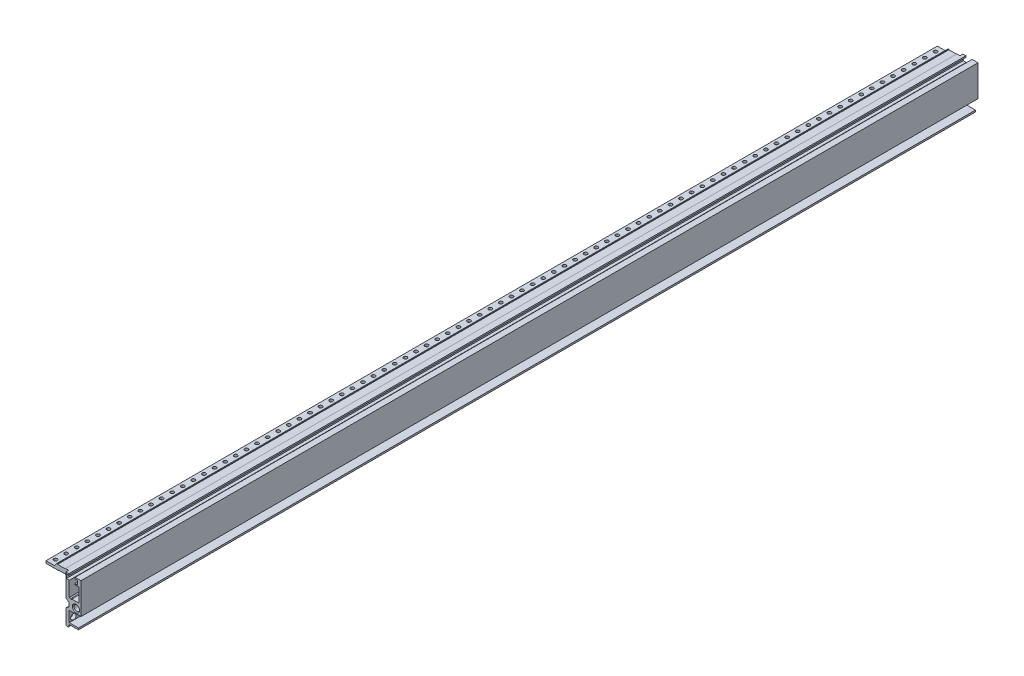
SolidWorks part; units mm, degrees
ref_plane "前视基准面" through (0, 0, 0) normal (0, 0, 1) x (1, 0, 0)
ref_plane "上视基准面" through (0, 0, 0) normal (0, 1, 0) x (1, 0, 0)
ref_plane "右视基准面" through (0, 0, 0) normal (1, 0, 0) x (0, 0, -1)
sketch "Model" plane through (0, 0, 0) normal (0, 0, 1) x (1, 0, 0)
  line L0 (2281.8705, 1522.2598) -> (2281.8705, 1503.7598)
  line L1 (2277.6705, 1503.7598) -> (2277.6705, 1503.4598)
  line L2 (2280.6205, 1518.3598) -> (2280.6205, 1510.0598)
  line L3 (2278.3705, 1522.2598) -> (2278.3705, 1521.3598)
  line L4 (2274.6705, 1522.2598) -> (2274.6705, 1521.3598)
  line L5 (2270.9705, 1522.2598) -> (2270.9705, 1522.0098)
  line L6 (2281.8705, 1522.2598) -> (2278.3705, 1522.2598)
  line L7 (2281.8705, 1503.7598) -> (2277.6705, 1503.7598)
  line L8 (2280.3705, 1496.1598) -> (2274.8705, 1496.1598)
  line L9 (2280.3705, 1497.1598) -> (2274.8705, 1497.1598)
  line L10 (2280.6205, 1518.3598) -> (2278.2705, 1518.3598)
  line L11 (2280.6205, 1510.0598) -> (2276.5105, 1510.0598)
  line L12 (2275.8305, 1510.0598) -> (2274.8705, 1510.0598)
  line L13 (2279.9205, 1518.9598) -> (2278.2705, 1518.9598)
  line L14 (2279.9205, 1521.3598) -> (2278.3705, 1521.3598)
  line L15 (2274.6705, 1522.2598) -> (2270.9705, 1522.2598)
  line L16 (2266.5705, 1519.0598) -> (2259.3705, 1519.0598)
  line L17 (2270.9705, 1519.3098) -> (2266.5705, 1519.3098)
  line L18 (2264.5705, 1520.4598) -> (2259.3705, 1520.4598)
  line L19 (2270.9705, 1522.0098) -> (2266.2705, 1522.0098)
  line L20 (2259.3705, 1520.4598) -> (2259.3705, 1519.0598)
  line L21 (2266.5705, 1519.3098) -> (2266.5705, 1519.0598)
  line L22 (2266.2705, 1522.2598) -> (2266.2705, 1522.0098)
  line L23 (2266.2705, 1522.2598) -> (2265.7705, 1522.2598)
  line L24 (2272.8705, 1516.5598) -> (2272.8705, 1508.9598)
  line L25 (2272.8705, 1503.7598) -> (2272.8705, 1495.5598)
  line L26 (2280.3705, 1497.1598) -> (2280.3705, 1496.1598)
  line L27 (2274.8705, 1496.1598) -> (2274.8705, 1495.5598)
  line L28 (2274.8705, 1507.3598) -> (2274.8705, 1505.3598)
  line L29 (2274.6705, 1521.3598) -> (2273.1205, 1521.3598)
  line L30 (2279.9205, 1521.3598) -> (2279.9205, 1518.9598)
  line L31 (2273.1205, 1521.3598) -> (2273.1205, 1518.9598)
  line L32 (2274.8705, 1518.9598) -> (2273.1205, 1518.9598)
  line L33 (2270.9705, 1519.3098) -> (2270.9705, 1519.0598)
  line L34 (2278.2705, 1518.9598) -> (2278.2705, 1518.3598)
  line L35 (2272.8705, 1508.9598) -> (2274.8705, 1507.3598)
  line L36 (2274.8705, 1505.3598) -> (2272.8705, 1503.7598)
  line L37 (2274.8705, 1518.9598) -> (2274.8705, 1510.0598)
  line L38 (2277.6705, 1503.4598) -> (2274.8705, 1503.4598)
  line L39 (2274.8705, 1497.1598) -> (2274.8705, 1503.4598)
  line L43 (2264.5705, 1520.4598) -> (2265.7705, 1522.2598)
  line L44 (2270.9705, 1519.0598) -> (2272.8705, 1516.5598)
  arc A0 (2275.8305, 1510.0598) -> (2276.5105, 1510.0598) centre (2276.1705, 1510.0598) ccw
  arc A1 (2272.8705, 1495.5598) -> (2274.8705, 1495.5598) centre (2273.8705, 1495.5598) ccw
extrude "凸台-拉伸1" add sketch "Model" along normal blind 533.4
hole_wizard "M4 螺纹孔1" positions "草图3" profile "草图2" tap size "M4" standard "Gb"
sketch "草图3" plane through (0, 0, 533.4) normal (0, 0, 1) x (1, 0, 0)
  line L0 (2281.8705, 1503.7598) -> (2281.8705, 1522.2598) construction
  line L1 (2281.8705, 1522.2598) -> (2278.3705, 1522.2598) construction
  point P0 (2278.8705, 1506.4598)
  dimension "D1" = 3
  dimension "D2" = 15.8
sketch "草图2" plane through (2278.8705, 1506.4598, 533.4) normal (1, 0, 0) x (0, -1, 0)
  line L0 (0, 0) -> (0, 24.4914)
  line L1 (0, 24.4914) -> (1.65, 23.5)
  line L2 (1.65, 23.5) -> (1.65, 0)
  line L5 (1.65, 0) -> (0, 0)
  line L10 (0, 24.4914) -> (-1.65, 23.5) construction
  line L11 (0, -6.35) -> (0, 107.95) construction
  dimension "螺纹孔钻头直径" = 3.3
  dimension "螺纹孔钻头深度" = 23.5
  dimension "导头角度" = 118
hole_wizard "M4 螺纹孔2" positions "草图5" profile "草图4" tap size "M4" standard "Gb"
sketch "草图5" plane through (0, 0, 0) normal (0, 0, -1) x (-1, 0, 0)
  line L0 (-2281.8705, 1503.7598) -> (-2281.8705, 1522.2598) construction
  line L1 (-2281.8705, 1522.2598) -> (-2278.3705, 1522.2598) construction
  point P0 (-2278.8705, 1506.4598)
  dimension "D1" = 3
  dimension "D2" = 15.8
sketch "草图4" plane through (2278.8705, 1506.4598, 0) normal (1, 0, 0) x (0, 1, 0)
  line L0 (0, 0) -> (0, 24.4914)
  line L1 (0, 24.4914) -> (1.65, 23.5)
  line L2 (1.65, 23.5) -> (1.65, 0)
  line L5 (1.65, 0) -> (0, 0)
  line L10 (0, 24.4914) -> (-1.65, 23.5) construction
  line L11 (0, -6.35) -> (0, 107.95) construction
  dimension "螺纹孔钻头直径" = 3.3
  dimension "螺纹孔钻头深度" = 23.5
  dimension "导头角度" = 118
chamfer "倒角1" distance 0.5 angle 45 2 edges at (2277.2205, 1506.4598, 0) (2280.5205, 1506.4598, 533.4)
sketch "草图6" plane through (2272.8705, 0, 0) normal (-1, 0, 0) x (0, 0, 1)
  line L0 (533.4, 1503.7598) -> (533.4, 1495.5598) construction
  line L1 (533.4, 1522.2598) -> (0, 1522.2598) construction
  circle A0 centre (530.86, 1498.9598) radius 1.65
  circle A1 centre (525.78, 1498.9598) radius 1.65
  circle A2 centre (520.7, 1498.9598) radius 1.65
  circle A3 centre (515.62, 1498.9598) radius 1.65
  circle A4 centre (510.54, 1498.9598) radius 1.65
  circle A5 centre (505.46, 1498.9598) radius 1.65
  circle A6 centre (500.38, 1498.9598) radius 1.65
  circle A7 centre (495.3, 1498.9598) radius 1.65
  circle A8 centre (490.22, 1498.9598) radius 1.65
  circle A9 centre (485.14, 1498.9598) radius 1.65
  circle A10 centre (480.06, 1498.9598) radius 1.65
  circle A11 centre (474.98, 1498.9598) radius 1.65
  circle A12 centre (469.9, 1498.9598) radius 1.65
  circle A13 centre (464.82, 1498.9598) radius 1.65
  circle A14 centre (459.74, 1498.9598) radius 1.65
  circle A15 centre (454.66, 1498.9598) radius 1.65
  circle A16 centre (449.58, 1498.9598) radius 1.65
  circle A17 centre (444.5, 1498.9598) radius 1.65
  circle A18 centre (439.42, 1498.9598) radius 1.65
  circle A19 centre (434.34, 1498.9598) radius 1.65
  circle A20 centre (429.26, 1498.9598) radius 1.65
  circle A21 centre (424.18, 1498.9598) radius 1.65
  circle A22 centre (419.1, 1498.9598) radius 1.65
  circle A23 centre (414.02, 1498.9598) radius 1.65
  circle A24 centre (408.94, 1498.9598) radius 1.65
  circle A25 centre (403.86, 1498.9598) radius 1.65
  circle A26 centre (398.78, 1498.9598) radius 1.65
  circle A27 centre (393.7, 1498.9598) radius 1.65
  circle A28 centre (388.62, 1498.9598) radius 1.65
  circle A29 centre (383.54, 1498.9598) radius 1.65
  circle A30 centre (378.46, 1498.9598) radius 1.65
  circle A31 centre (373.38, 1498.9598) radius 1.65
  circle A32 centre (368.3, 1498.9598) radius 1.65
  circle A33 centre (363.22, 1498.9598) radius 1.65
  circle A34 centre (358.14, 1498.9598) radius 1.65
  circle A35 centre (353.06, 1498.9598) radius 1.65
  circle A36 centre (347.98, 1498.9598) radius 1.65
  circle A37 centre (342.9, 1498.9598) radius 1.65
  circle A38 centre (337.82, 1498.9598) radius 1.65
  circle A39 centre (332.74, 1498.9598) radius 1.65
  circle A40 centre (327.66, 1498.9598) radius 1.65
  circle A41 centre (322.58, 1498.9598) radius 1.65
  circle A42 centre (317.5, 1498.9598) radius 1.65
  circle A43 centre (312.42, 1498.9598) radius 1.65
  circle A44 centre (307.34, 1498.9598) radius 1.65
  circle A45 centre (302.26, 1498.9598) radius 1.65
  circle A46 centre (297.18, 1498.9598) radius 1.65
  circle A47 centre (292.1, 1498.9598) radius 1.65
  circle A48 centre (287.02, 1498.9598) radius 1.65
  circle A49 centre (281.94, 1498.9598) radius 1.65
  circle A50 centre (276.86, 1498.9598) radius 1.65
  circle A51 centre (271.78, 1498.9598) radius 1.65
  circle A52 centre (266.7, 1498.9598) radius 1.65
  circle A53 centre (261.62, 1498.9598) radius 1.65
  circle A54 centre (256.54, 1498.9598) radius 1.65
  circle A55 centre (251.46, 1498.9598) radius 1.65
  circle A56 centre (246.38, 1498.9598) radius 1.65
  circle A57 centre (241.3, 1498.9598) radius 1.65
  circle A58 centre (236.22, 1498.9598) radius 1.65
  circle A59 centre (231.14, 1498.9598) radius 1.65
  circle A60 centre (226.06, 1498.9598) radius 1.65
  circle A61 centre (220.98, 1498.9598) radius 1.65
  circle A62 centre (215.9, 1498.9598) radius 1.65
  circle A63 centre (210.82, 1498.9598) radius 1.65
  circle A64 centre (205.74, 1498.9598) radius 1.65
  circle A65 centre (200.66, 1498.9598) radius 1.65
  circle A66 centre (195.58, 1498.9598) radius 1.65
  circle A67 centre (190.5, 1498.9598) radius 1.65
  circle A68 centre (185.42, 1498.9598) radius 1.65
  circle A69 centre (180.34, 1498.9598) radius 1.65
  circle A70 centre (175.26, 1498.9598) radius 1.65
  circle A71 centre (170.18, 1498.9598) radius 1.65
  circle A72 centre (165.1, 1498.9598) radius 1.65
  circle A73 centre (160.02, 1498.9598) radius 1.65
  circle A74 centre (154.94, 1498.9598) radius 1.65
  circle A75 centre (149.86, 1498.9598) radius 1.65
  circle A76 centre (144.78, 1498.9598) radius 1.65
  circle A77 centre (139.7, 1498.9598) radius 1.65
  circle A78 centre (134.62, 1498.9598) radius 1.65
  circle A79 centre (129.54, 1498.9598) radius 1.65
  circle A80 centre (124.46, 1498.9598) radius 1.65
  circle A81 centre (119.38, 1498.9598) radius 1.65
  circle A82 centre (114.3, 1498.9598) radius 1.65
  circle A83 centre (109.22, 1498.9598) radius 1.65
  circle A84 centre (104.14, 1498.9598) radius 1.65
  circle A85 centre (99.06, 1498.9598) radius 1.65
  circle A86 centre (93.98, 1498.9598) radius 1.65
  circle A87 centre (88.9, 1498.9598) radius 1.65
  circle A88 centre (83.82, 1498.9598) radius 1.65
  circle A89 centre (78.74, 1498.9598) radius 1.65
  circle A90 centre (73.66, 1498.9598) radius 1.65
  circle A91 centre (68.58, 1498.9598) radius 1.65
  circle A92 centre (63.5, 1498.9598) radius 1.65
  circle A93 centre (58.42, 1498.9598) radius 1.65
  circle A94 centre (53.34, 1498.9598) radius 1.65
  circle A95 centre (48.26, 1498.9598) radius 1.65
  circle A96 centre (43.18, 1498.9598) radius 1.65
  circle A97 centre (38.1, 1498.9598) radius 1.65
  circle A98 centre (33.02, 1498.9598) radius 1.65
  circle A99 centre (27.94, 1498.9598) radius 1.65
  circle A100 centre (22.86, 1498.9598) radius 1.65
  circle A101 centre (17.78, 1498.9598) radius 1.65
  circle A102 centre (12.7, 1498.9598) radius 1.65
  circle A103 centre (7.62, 1498.9598) radius 1.65
  circle A104 centre (2.54, 1498.9598) radius 1.65
extrude "切除-拉伸1" cut sketch "草图6" against normal blind 10
hole_wizard "M2.5 螺纹孔1"
sketch "草图8" plane through (0, 1520.4598, 0) normal (0, 1, 0) x (1, 0, 0)
  line L0 (2264.5705, -533.4) -> (2259.3705, -533.4) construction
  line L1 (2259.3705, -533.4) -> (2259.3705, 0) construction
  line L2 (2264.5705, 0) -> (2259.3705, 0) construction
  point P0 (2261.6705, -528.32)
  point P13 (2261.6705, -522.0159)
  point P14 (2261.6705, -515.7118)
  point P15 (2261.6705, -509.4077)
  point P16 (2261.6705, -503.1036)
  point P17 (2261.6705, -496.7995)
  point P18 (2261.6705, -490.4954)
  point P19 (2261.6705, -484.1913)
  point P20 (2261.6705, -477.8872)
  point P21 (2261.6705, -471.5831)
  point P22 (2261.6705, -465.279)
  point P23 (2261.6705, -458.9749)
  point P24 (2261.6705, -452.6708)
  point P25 (2261.6705, -446.3667)
  point P26 (2261.6705, -440.0627)
  point P27 (2261.6705, -433.7586)
  point P28 (2261.6705, -427.4545)
  point P29 (2261.6705, -421.1504)
  point P30 (2261.6705, -414.8463)
  point P31 (2261.6705, -408.5422)
  point P32 (2261.6705, -402.2381)
  point P33 (2261.6705, -395.934)
  point P34 (2261.6705, -389.6299)
  point P35 (2261.6705, -383.3258)
  point P36 (2261.6705, -377.0217)
  point P37 (2261.6705, -370.7176)
  point P38 (2261.6705, -364.4135)
  point P39 (2261.6705, -358.1094)
  point P40 (2261.6705, -351.8053)
  point P41 (2261.6705, -345.5012)
  point P42 (2261.6705, -339.1971)
  point P43 (2261.6705, -332.893)
  point P44 (2261.6705, -326.5889)
  point P45 (2261.6705, -320.2848)
  point P46 (2261.6705, -313.9807)
  point P47 (2261.6705, -307.6766)
  point P48 (2261.6705, -301.3725)
  point P49 (2261.6705, -295.0684)
  point P50 (2261.6705, -288.7643)
  point P51 (2261.6705, -282.4602)
  point P52 (2261.6705, -276.1561)
  point P53 (2261.6705, -269.852)
  point P54 (2261.6705, -263.548)
  point P55 (2261.6705, -257.2439)
  point P56 (2261.6705, -250.9398)
  point P57 (2261.6705, -244.6357)
  point P58 (2261.6705, -238.3316)
  point P59 (2261.6705, -232.0275)
  point P60 (2261.6705, -225.7234)
  point P61 (2261.6705, -219.4193)
  point P62 (2261.6705, -213.1152)
  point P63 (2261.6705, -206.8111)
  point P64 (2261.6705, -200.507)
  point P65 (2261.6705, -194.2029)
  point P66 (2261.6705, -187.8988)
  point P67 (2261.6705, -181.5947)
  point P68 (2261.6705, -175.2906)
  point P69 (2261.6705, -168.9865)
  point P70 (2261.6705, -162.6824)
  point P71 (2261.6705, -156.3783)
  point P72 (2261.6705, -150.0742)
  point P73 (2261.6705, -143.7701)
  point P74 (2261.6705, -137.466)
  point P75 (2261.6705, -131.1619)
  point P76 (2261.6705, -124.8578)
  point P77 (2261.6705, -118.5537)
  point P78 (2261.6705, -112.2496)
  point P79 (2261.6705, -105.9455)
  point P80 (2261.6705, -99.6414)
  point P81 (2261.6705, -93.3373)
  point P82 (2261.6705, -87.0333)
  point P83 (2261.6705, -80.7292)
  point P84 (2261.6705, -74.4251)
  point P85 (2261.6705, -68.121)
  point P86 (2261.6705, -61.8169)
  point P87 (2261.6705, -55.5128)
  point P88 (2261.6705, -49.2087)
  point P89 (2261.6705, -42.9046)
  point P90 (2261.6705, -36.6005)
  point P91 (2261.6705, -30.2964)
  point P92 (2261.6705, -23.9923)
  point P93 (2261.6705, -17.6882)
  point P94 (2261.6705, -11.3841)
  point P95 (2261.6705, -5.08)
  dimension "D1" = 5.08
  dimension "D2" = 2.3
  dimension "D4" = 5.08
  dimension "D3" = 84
sketch "草图7" plane through (2261.6705, 1520.4598, 528.32) normal (1, 0, 0) x (0, 0, 1)
  line L0 (0, 0) -> (0, 7.8659)
  line L1 (0, 7.8659) -> (1.025, 7.25)
  line L2 (1.025, 7.25) -> (1.025, 0)
  line L5 (1.025, 0) -> (0, 0)
  line L10 (0, 7.8659) -> (-1.025, 7.25) construction
  line L11 (0, -6.35) -> (0, 107.95) construction
  dimension "螺纹孔钻头直径" = 2.05
  dimension "螺纹孔钻头深度" = 7.25
  dimension "导头角度" = 118
sketch "草图9" plane through (0, 1519.0598, 0) normal (0, -1, 0) x (1, 0, 0)
  line L0 (2272.8705, 533.4) -> (2272.8705, 0) construction
  line L2 (2259.3705, 533.4) -> (2272.8705, 533.4)
  line L3 (2259.3705, 533.4) -> (2259.3705, 531.7)
  line L4 (2259.3705, 531.7) -> (2272.8705, 531.7)
  line L5 (2272.8705, 533.4) -> (2272.8705, 531.7)
  line L6 (2259.3705, 0) -> (2272.8705, 0)
  line L7 (2259.3705, 0) -> (2259.3705, 1.7)
  line L8 (2259.3705, 1.7) -> (2272.8705, 1.7)
  line L9 (2272.8705, 0) -> (2272.8705, 1.7)
  dimension "D1" = 1.7
  dimension "D2" = 1.7
extrude "切除-拉伸2" cut sketch "草图9" against normal through all and the other way through all
equation "\"D4@草图6\"=\"D1@凸台-拉伸1\"/5.08"
